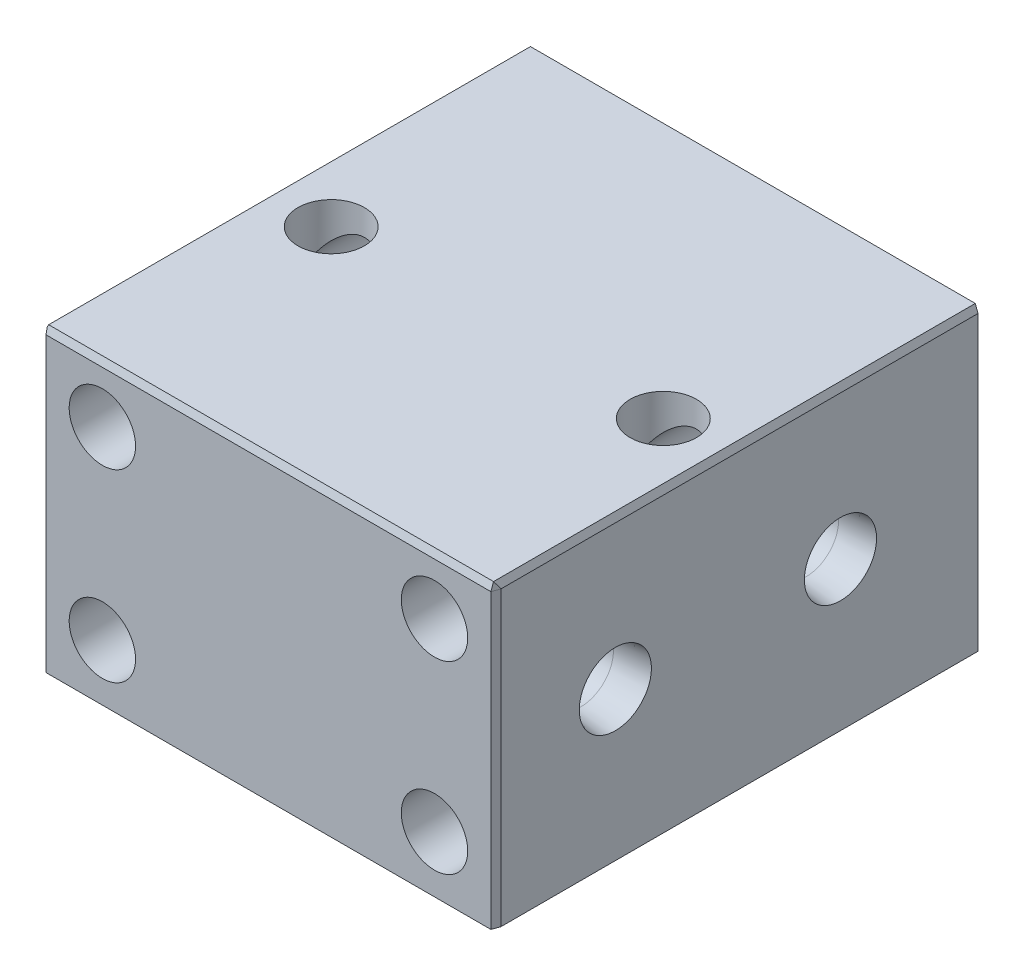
SolidWorks part; units mm, degrees
ref_plane "Front Plane" through (0, 0, 0) normal (0, 0, 1) x (1, 0, 0)
ref_plane "Top Plane" through (0, 0, 0) normal (0, 1, 0) x (1, 0, 0)
ref_plane "Right Plane" through (0, 0, 0) normal (1, 0, 0) x (0, 0, -1)
sketch "Sketch1" plane through (0, 0, 0) normal (0, 0, 1) x (1, 0, 0)
  line L1 (-30.5, 20.5) -> (30.5, 20.5)
  line L2 (-30.5, 20.5) -> (-30.5, -20.5)
  line L3 (-30.5, -20.5) -> (30.5, -20.5)
  line L4 (30.5, 20.5) -> (30.5, -20.5)
  line L5 (-30.5, 20.5) -> (30.5, -20.5) construction
  line L6 (-30.5, -20.5) -> (30.5, 20.5) construction
  point P0 (0, 0)
  dimension "D1" = 61
  dimension "D2" = 41
extrude "Boss-Extrude1" add sketch "Sketch1" along normal blind 66
sketch "Sketch2" plane through (0, 0, 0) normal (0, 0, -1) x (-1, 0, 0)
  circle A0 centre (0, 0) radius 6
  dimension "D1" = 12
extrude "Cut-Extrude1" cut sketch "Sketch2" against normal blind 50
sketch "Sketch3" plane through (0, 0, 0) normal (0, 0, -1) x (-1, 0, 0)
  circle A0 centre (-22.5, 12.5) radius 4.5
  circle A1 centre (-22.5, -12.5) radius 4.5
  circle A2 centre (22.5, 12.5) radius 4.5
  circle A3 centre (22.5, -12.5) radius 4.5
  dimension "D9" = 9
  dimension "D10" = 9
  dimension "D11" = 9
  dimension "D12" = 9
  dimension "D1" = 22.5
  dimension "D2" = 22.5
  dimension "D3" = 12.5
  dimension "D4" = 12.5
  dimension "D5" = 22.5
  dimension "D6" = 22.5
  dimension "D7" = 12.5
  dimension "D8" = 25
extrude "Cut-Extrude2" cut sketch "Sketch3" against normal through all
sketch "Sketch4" plane through (0, 20.5, 0) normal (0, 1, 0) x (1, 0, 0)
  circle A0 centre (-22.5, -35) radius 4.5
  circle A1 centre (22.5, -35) radius 4.5
  dimension "D5" = 9
  dimension "D6" = 9
  dimension "D1" = 35
  dimension "D2" = 35
  dimension "D3" = 22.5
  dimension "D4" = 22.5
extrude "Cut-Extrude3" cut sketch "Sketch4" against normal through all
hole_wizard "G1/8 Tapped Hole1" positions "Sketch7" profile "Sketch8" tap size "G1/8" standard "GB"
sketch "Sketch7" plane through (30.5, 0, 0) normal (1, 0, 0) x (0, 0, -1)
  line L0 (0, -20.5) -> (0, 20.5) construction
  line L1 (-66, -20.5) -> (-66, 20.5) construction
  point P0 (-19, 0)
  point P2 (-49.5, 0)
  dimension "D1" = 19
  dimension "D2" = 16.5
sketch "Sketch8" plane through (30.5, 0, 19) normal (0, 1, 0) x (0, 0, -1)
  line L0 (0, 0) -> (0, 15.6438)
  line L1 (0, 15.6438) -> (4.4, 13)
  line L2 (4.4, 13) -> (4.4, 4.6525)
  line L3 (4.4, 4.6525) -> (4.889, 0)
  line L5 (4.889, 0) -> (0, 0)
  line L6 (-4.4, 4.6525) -> (-4.889, 0) construction
  line L10 (0, 15.6438) -> (-4.4, 13) construction
  line L11 (0, -6.35) -> (0, 107.95) construction
  dimension "Tap Drill Dia." = 8.8
  dimension "Tap Drill Depth" = 13
  dimension "Near C'Sink Dia." = 9.778
  dimension "Near C'Sink Angle" = 12
  dimension "Drill Angle" = 118
sketch "Sketch9" plane through (0, -20.5, 0) normal (0, -1, 0) x (1, 0, 0)
  line L0 (-30.5, 66) -> (30.5, 66) construction
  circle A0 centre (0, 49.5) radius 5
  circle A1 centre (0, 19) radius 5
  dimension "D3" = 10
  dimension "D4" = 10
  dimension "D1" = 16.5
  dimension "D2" = 19
extrude "Cut-Extrude4" cut sketch "Sketch9" against normal blind 1.3
chamfer "Chamfer1" distance 1 angle 20 10 edges at (0, -20.5, 0) (-30.5, -20.5, 33) (0, -20.5, 66) (30.5, 0, 66) (30.5, -20.5, 33) (30.5, 0, 0) (-30.5, 20.5, 33) (0, 20.5, 66) (30.5, 20.5, 33) (0, 20.5, 0)
chamfer "Chamfer2" distance 1 angle 20 2 edges at (-30.5, 0, 66) (-30.5, 0, 0)
